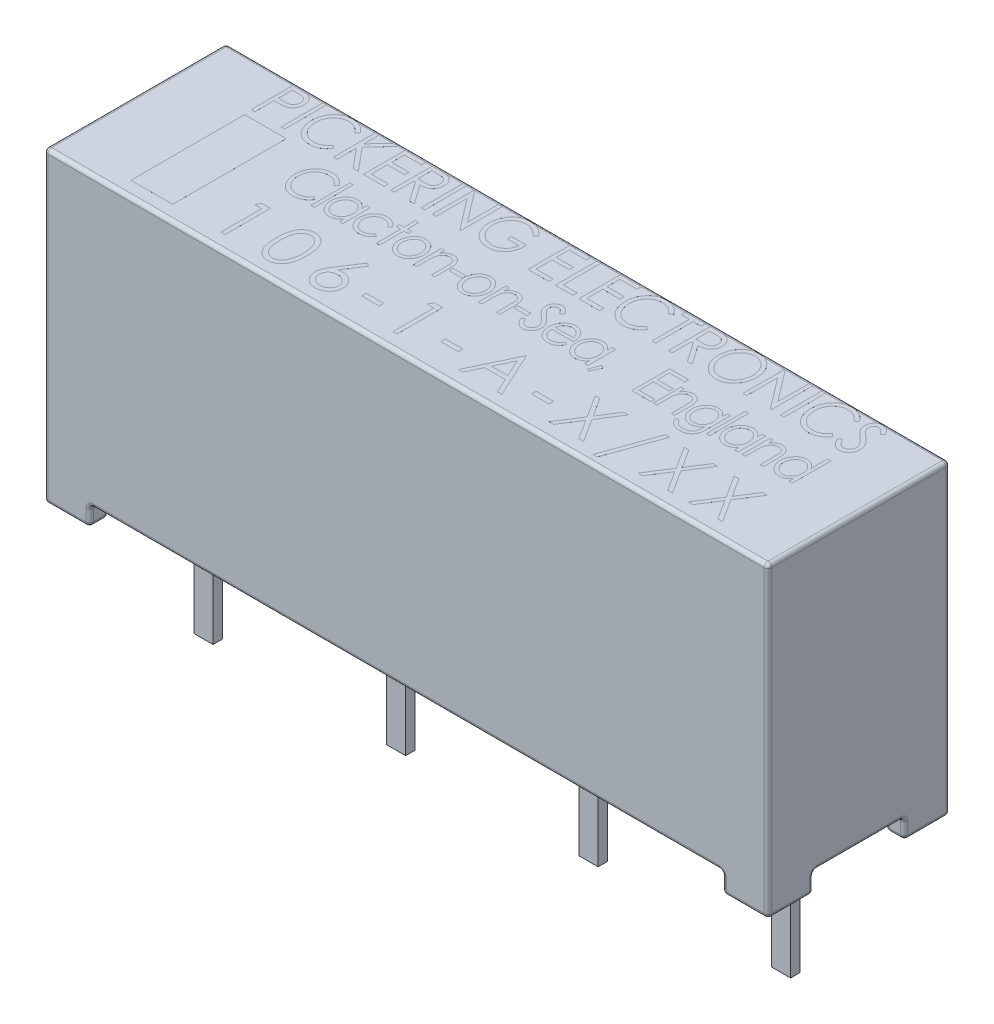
SolidWorks part; units mm, degrees
ref_plane "Front Plane" through (0, 0, 0) normal (0, 0, 1) x (1, 0, 0)
ref_plane "Top Plane" through (0, 0, 0) normal (0, 1, 0) x (1, 0, 0)
ref_plane "Right Plane" through (0, 0, 0) normal (1, 0, 0) x (0, 0, -1)
sketch "Sketch1" plane through (0, 0, 0) normal (0, 1, 0) x (1, 0, 0)
  line L1 (9.55, -2.4) -> (-9.55, -2.4)
  line L2 (9.55, -2.4) -> (9.55, 2.4)
  line L3 (9.55, 2.4) -> (-9.55, 2.4)
  line L4 (-9.55, -2.4) -> (-9.55, 2.4)
  line L5 (9.55, -2.4) -> (-9.55, 2.4) construction
  line L6 (9.55, 2.4) -> (-9.55, -2.4) construction
  point P0 (0, 0)
  dimension "D1" = 4.8
  dimension "D2" = 19.1
extrude "Main Body" add sketch "Sketch1" along normal blind 7.592
sketch "Sketch2" plane through (0, 0, 0) normal (0, -1, 0) x (1, 0, 0)
  line L1 (-9.55, 2.4) -> (-8.35, 2.4)
  line L2 (-9.55, 2.4) -> (-9.55, 1.2)
  line L3 (-9.55, 1.2) -> (-9.05, 1.2)
  line L4 (-8.35, 2.4) -> (-8.35, 1.9)
  line L7 (-8.35, 1.9) -> (-9.05, 1.9)
  line L8 (-9.05, 1.2) -> (-9.05, 1.9)
  dimension "D1" = 1.2
  dimension "D2" = 1.2
  dimension "D3" = 0.5
  dimension "D4" = 0.5
extrude "Original Foot" add sketch "Sketch2" along normal blind 0.508
mirror "Left Foot" about plane through (0, 0, 0) normal (0, 0, 1) of "Original Foot"
mirror "Right Feet" about plane through (0, 0, 0) normal (1, 0, 0) of "Left Foot", "Original Foot"
sketch "Sketch3" plane through (0, 0, 0) normal (0, -1, 0) x (1, 0, 0)
  line L0 (9.55, 1.2) -> (9.55, -1.2) construction
  line L1 (-7.366, -0.127) -> (-7.874, -0.127)
  line L2 (-7.366, -0.127) -> (-7.366, 0.127)
  line L3 (-7.366, 0.127) -> (-7.874, 0.127)
  line L4 (-7.874, -0.127) -> (-7.874, 0.127)
  line L5 (-7.366, -0.127) -> (-7.874, 0.127) construction
  line L6 (-7.366, 0.127) -> (-7.874, -0.127) construction
  line L7 (-2.286, -0.127) -> (-2.794, -0.127)
  line L8 (-2.286, -0.127) -> (-2.286, 0.127)
  line L9 (-2.286, 0.127) -> (-2.794, 0.127)
  line L10 (-2.794, -0.127) -> (-2.794, 0.127)
  line L11 (-2.286, -0.127) -> (-2.794, 0.127) construction
  line L12 (-2.286, 0.127) -> (-2.794, -0.127) construction
  line L13 (2.794, -0.127) -> (2.286, -0.127)
  line L14 (2.794, -0.127) -> (2.794, 0.127)
  line L15 (2.794, 0.127) -> (2.286, 0.127)
  line L16 (2.286, -0.127) -> (2.286, 0.127)
  line L17 (2.794, -0.127) -> (2.286, 0.127) construction
  line L18 (2.794, 0.127) -> (2.286, -0.127) construction
  line L19 (7.874, -0.127) -> (7.366, -0.127)
  line L20 (7.874, -0.127) -> (7.874, 0.127)
  line L21 (7.874, 0.127) -> (7.366, 0.127)
  line L22 (7.366, -0.127) -> (7.366, 0.127)
  line L23 (7.874, -0.127) -> (7.366, 0.127) construction
  line L24 (7.874, 0.127) -> (7.366, -0.127) construction
  point P0 (-7.62, 0)
  point P5 (-2.54, 0)
  point P10 (2.54, 0)
  point P15 (7.62, 0)
  dimension "D1" = 0.254
  dimension "D2" = 0.508
  dimension "D3" = 0.254
  dimension "D4" = 0.508
  dimension "D5" = 0.254
  dimension "D6" = 0.508
  dimension "D7" = 0.508
  dimension "D8" = 0.254
  dimension "D9" = 5.08
  dimension "D10" = 5.08
  dimension "D11" = 5.08
  dimension "D12" = 1.93
extrude "Pins" add sketch "Sketch3" along normal blind 3.808
sketch "Sketch4"
  dimension "D1" = 15.6
  dimension "D2" = 1.75
  dimension "D3" = 13.5
  dimension "D4" = 1.2
  dimension "D5" = 1.4
  dimension "D6" = 1.8
  dimension "D7" = 3
  dimension "D8" = 1.1
  dimension "D9" = 0.4
extrude "Lettering" add sketch "Sketch4" along normal blind 0.0001
fillet "Fillet1" radius 0.1 72 edges at (8.35, -0.254, -2.4) (8.35, -0.254, -1.9) (9.05, -0.254, -1.2) (9.55, -0.254, -1.2) (9.55, -0.254, 1.2) (9.05, -0.254, 1.2) (8.35, -0.254, 1.9) (8.35, -0.254, 2.4) (-9.55, -0.254, -1.2) (-9.05, -0.254, -1.2) (8.35, 0, -2.15) (9.3, 0, -1.2) (9.3, 0, 1.2) (8.35, 0, 2.15) (-9.3, 0, -1.2) (-8.7, 0, -1.9) (8.7, 0, -1.9) (9.05, -0.254, -1.9) (9.05, 0, -1.55) (9.05, 0, 1.55) (9.05, -0.254, 1.9) (8.7, 0, 1.9) (-8.35, -0.254, 1.9) (-8.7, 0, 1.9) (-9.05, -0.254, 1.2) (-9.05, -0.254, 1.9) (-9.05, 0, 1.55) (-9.05, -0.254, -1.9) (-9.05, 0, -1.55) (-8.35, -0.254, -2.4) (-8.35, -0.254, -1.9) (-8.35, 0, -2.15) (-9.3, -0.508, -1.2) (-9.05, -0.508, -1.55) (-8.7, -0.508, -1.9) (-8.35, -0.508, -2.15) (-8.95, -0.508, -2.4) (-9.55, -0.508, -1.8) (-8.95, -0.508, 2.4) (-8.35, -0.508, 2.15) (-8.7, -0.508, 1.9) (-9.05, -0.508, 1.55) (-9.3, -0.508, 1.2) (-9.55, -0.508, 1.8) (8.95, -0.508, -2.4) (8.35, -0.508, -2.15) (8.7, -0.508, -1.9) (9.05, -0.508, -1.55) (9.3, -0.508, -1.2) (9.55, -0.508, -1.8) (9.3, -0.508, 1.2) (9.05, -0.508, 1.55) (8.7, -0.508, 1.9) (8.35, -0.508, 2.15) (8.95, -0.508, 2.4) (9.55, -0.508, 1.8) (9.55, 0, 0) (0, 0, -2.4) (9.55, 3.542, 2.4) (0, 7.592, 2.4) (0, 7.592, -2.4) (9.55, 7.592, 0) (9.55, 3.542, -2.4) (-9.55, 7.592, 0) (-9.55, 3.542, -2.4) (-9.55, 3.542, 2.4)
